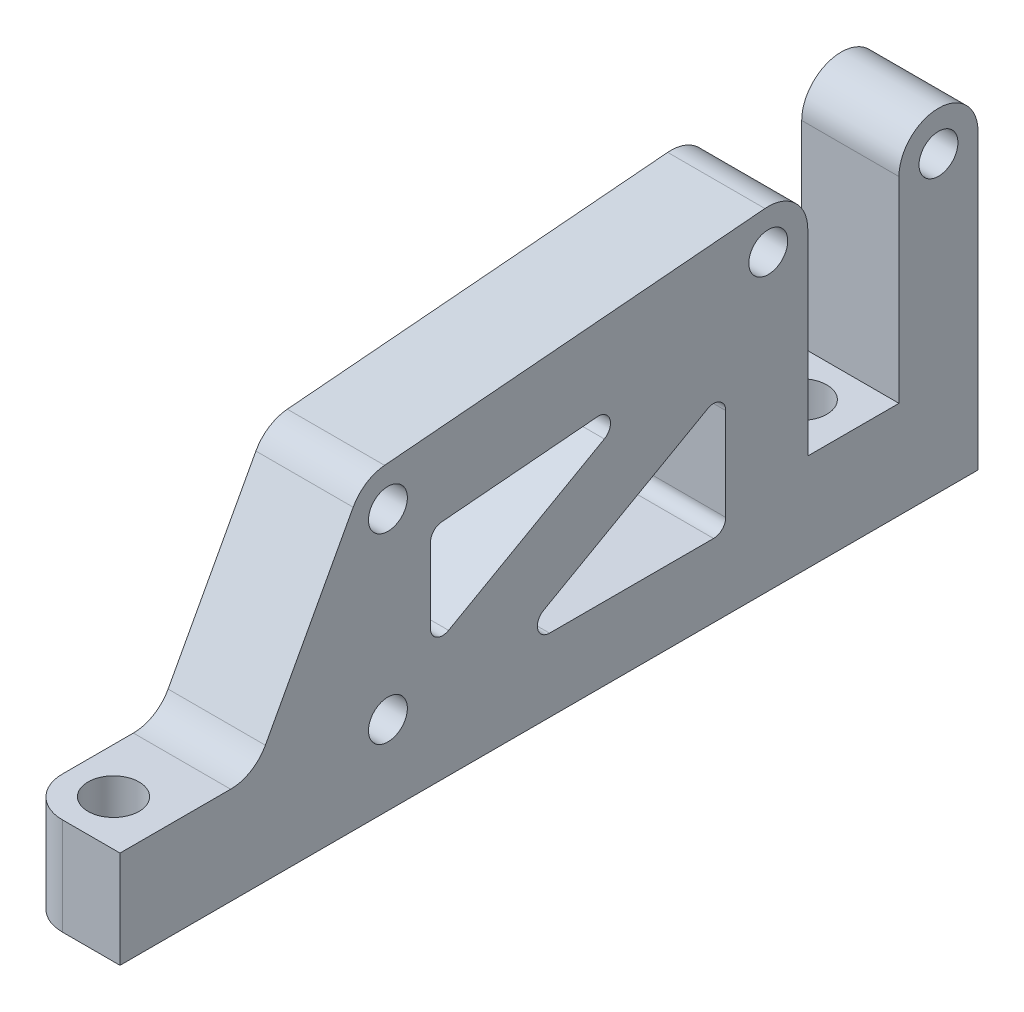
SolidWorks part; units mm, degrees
ref_plane "前视基准面" through (0, 0, 0) normal (0, 0, 1) x (1, 0, 0)
ref_plane "上视基准面" through (0, 0, 0) normal (0, 1, 0) x (1, 0, 0)
ref_plane "右视基准面" through (0, 0, 0) normal (1, 0, 0) x (0, 0, -1)
other "Configuration Table"
sketch "草图1" plane through (-24, 0, 0) normal (-1, 0, 0) x (0, 0, 1)
  line L0 (668.99, 143.3884) -> (702.0232, 140.5903)
  line L1 (651.4657, 140.15) -> (651.4657, 116)
  line L2 (739.4975, 116) -> (640.5025, 116) construction
  line L3 (651.4657, 116) -> (722.0343, 116)
  line L5 (711, 124) -> (702.0232, 140.5903)
  line L6 (657.9657, 140.15) -> (657.9657, 124)
  line L7 (657.9657, 124) -> (665.4657, 124)
  line L8 (665.4657, 124) -> (665.4657, 140.15)
  line L9 (711, 124) -> (722.0343, 124)
  line L10 (722.0343, 124) -> (722.0343, 116)
  circle A0 centre (654.7157, 140.15) radius 1.6
  circle A1 centre (668.7157, 140.15) radius 1.6
  circle A2 centre (700, 137.5) radius 1.6
  circle A3 centre (700, 122.5) radius 1.6
  arc A4 (651.4657, 140.15) -> (657.9657, 140.15) centre (654.7157, 140.15) cw
  arc A5 (665.4657, 140.15) -> (668.99, 143.3884) centre (668.7157, 140.15) cw
  dimension "D1" = 3.2
  dimension "D2" = 3.25
  dimension "D3" = 3.25
  dimension "D4" = 3.25
  dimension "D5" = 3.25
  dimension "D6" = 8
  dimension "D7" = 56.5685
  dimension "D8" = 11
extrude "凸台-拉伸1" add sketch "草图1" along normal blind 8
sketch "草图2" plane through (0, 116, 0) normal (0, -1, 0) x (1, 0, 0)
  circle A0 centre (-28.2843, 718.2843) radius 2.1
  circle A1 centre (-28.2843, 661.7157) radius 2.1
  dimension "D1" = 4.2
extrude "切除-拉伸1" cut sketch "草图2" against normal through all
sketch "草图3" plane through (0, 124, 0) normal (0, 1, 0) x (1, 0, 0)
  circle A0 centre (-33.9411, -668.7868) radius 3
  circle A1 centre (-33.9411, -711.2132) radius 3
  dimension "D1" = 6
  dimension "D2" = 6
extrude "切除-拉伸2" cut sketch "草图3" against normal through all from offset 5
fillet "圆角1" radius 3.25 2 edges at (-28, 124, 711) (-28, 140.5903, 702.0232)
fillet "圆角2" radius 3.25 1 edges at (-32, 120, 722.0343)
sketch "草图4" plane through (-32, 0, 0) normal (-1, 0, 0) x (0, 0, 1)
  line L0 (678.2031, 135.8338) -> (696.5, 134.2839)
  line L1 (696.5, 134.2839) -> (696.5, 125.5111)
  line L2 (696.5, 125.5111) -> (678.2031, 135.8338)
  line L3 (672.2157, 132.3228) -> (690.5126, 122)
  line L4 (690.5126, 122) -> (672.2157, 122)
  line L5 (672.2157, 122) -> (672.2157, 132.3228)
  line L6 (665.4657, 140.15) -> (665.4657, 124) construction
  line L7 (700.2743, 140.7384) -> (668.99, 143.3884) construction
  line L8 (651.4657, 116) -> (666.4994, 116) construction
  line L9 (668.7157, 140.15) -> (700, 122.5) construction
  dimension "D1" = 6.75
  dimension "D2" = 6
  dimension "D3" = 6
  dimension "D4" = 3.5
  dimension "D5" = 21.008
  dimension "D6" = 6.75
extrude "切除-拉伸3" cut sketch "草图4" against normal through all
fillet "圆角3" radius 1 6 edges at (-28, 135.8338, 678.2031) (-28, 134.2839, 696.5) (-28, 125.5111, 696.5) (-28, 132.3228, 672.2157) (-28, 122, 690.5126) (-28, 122, 672.2157)
